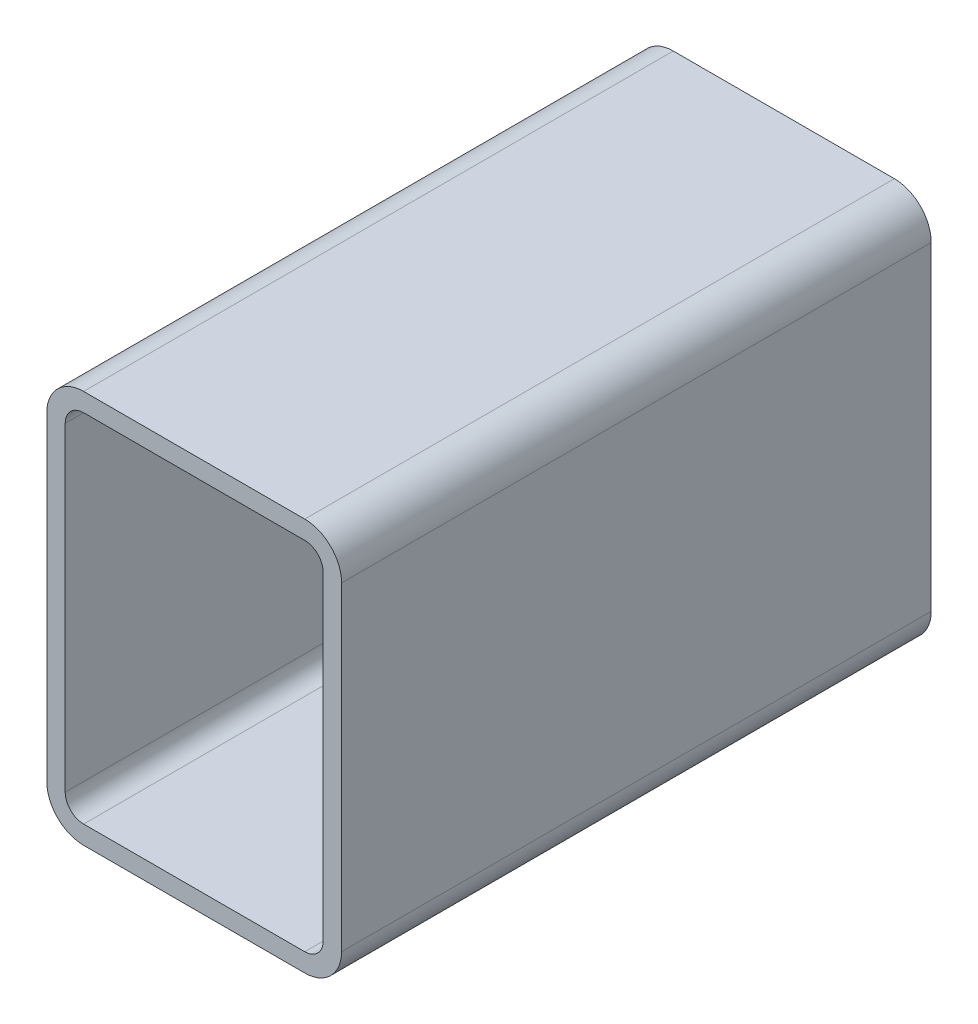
SolidWorks part; units mm, degrees
ref_plane "Front Plane" through (0, 0, 0) normal (0, 0, 1) x (1, 0, 0)
ref_plane "Top Plane" through (0, 0, 0) normal (0, 1, 0) x (1, 0, 0)
ref_plane "Right Plane" through (0, 0, 0) normal (1, 0, 0) x (0, 0, -1)
sketch "Sketch1" plane through (0, 0, 0) normal (0, 0, 1) x (1, 0, 0)
sketch_block_instance "HSS8x6x0.375-1"
sketch_block "HSS8x6x0.375"
extrude "Boss-Extrude1" add sketch "Sketch1" along normal blind 304.8
